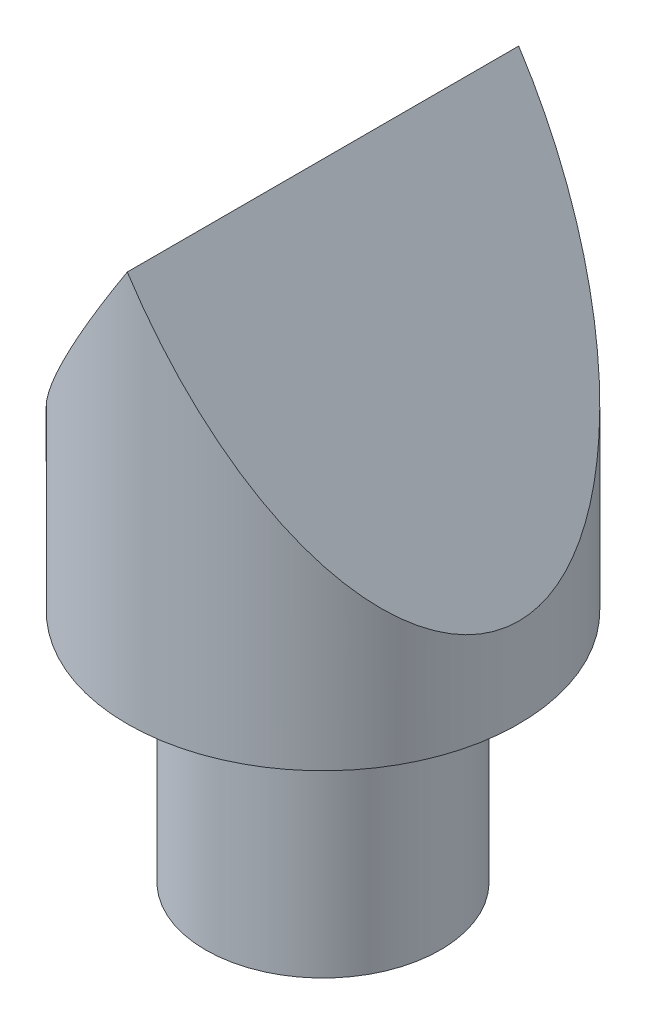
SolidWorks part; units mm, degrees
ref_plane "前视基准面" through (0, 0, 0) normal (0, 0, 1) x (1, 0, 0)
ref_plane "上视基准面" through (0, 0, 0) normal (0, 1, 0) x (1, 0, 0)
ref_plane "右视基准面" through (0, 0, 0) normal (1, 0, 0) x (0, 0, -1)
sketch "草图1" plane through (0, 0, 0) normal (0, 1, 0) x (1, 0, 0)
  circle A0 centre (0, 0) radius 25
  dimension "D1" = 50
extrude "拉伸1" add sketch "草图1" along normal blind 50
sketch "草图2" plane through (0, 0, 0) normal (0, 1, 0) x (1, 0, 0)
  circle A0 centre (0, 0) radius 15
  dimension "D1" = 30
extrude "拉伸2" add sketch "草图2" against normal blind 30
sketch "草图5" plane through (0, 0, 0) normal (0, 0, 1) x (1, 0, 0)
  line L0 (0, 50) -> (-25, 11.3745)
  line L1 (0, 0.9266) -> (0, 53.6755) construction
  line L2 (25, 50) -> (-25, 50) construction
  line L3 (-25, 50) -> (-25, 0) construction
  line L6 (-25, 11.3745) -> (-25, 50)
  line L7 (-25, 50) -> (0, 50)
extrude "切除-拉伸5" cut sketch "草图5" against normal mid plane 80
sketch "草图7" plane through (0, 0, 0) normal (0, 0, 1) x (1, 0, 0)
  line L0 (0, 0) -> (0, 53.5217) construction
  line L3 (0, 50) -> (25, 50)
  line L5 (25, 50) -> (0, 50) construction
  line L6 (25, 50) -> (25, 11.3745)
  line L7 (25, 11.3745) -> (0, 50)
  line L8 (0, 50) -> (-25, 11.3745) construction
  point P14 (-25, 11.3745)
extrude "切除-拉伸6" cut sketch "草图7" against normal mid plane 80
